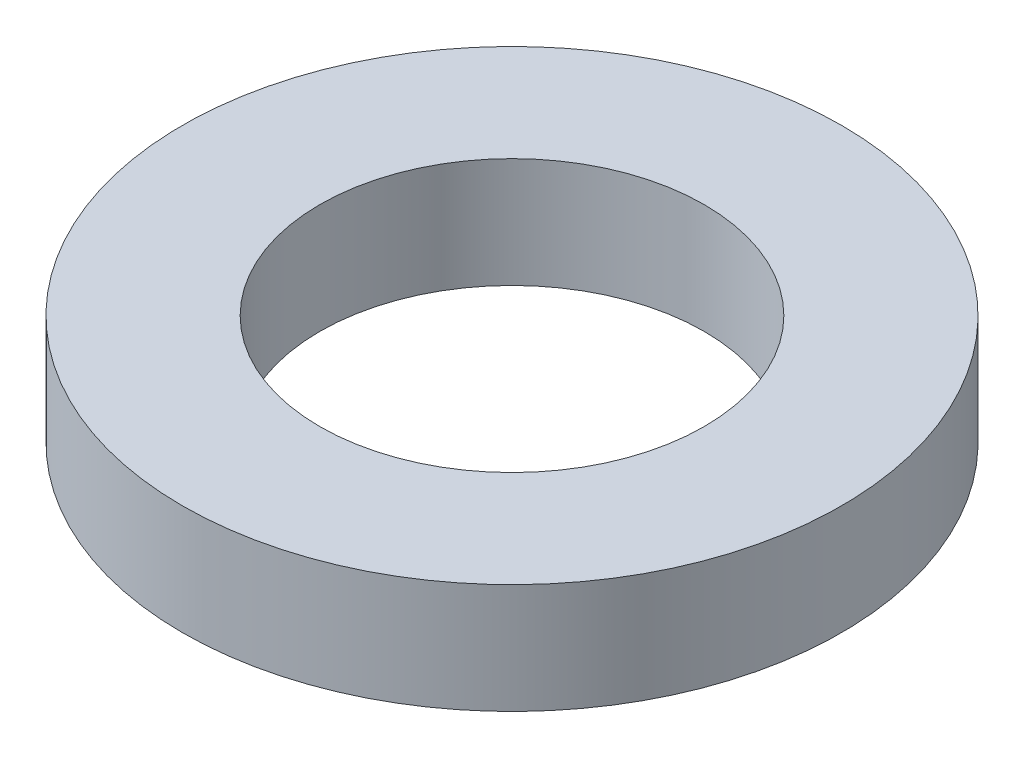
SolidWorks part; units mm, degrees
ref_plane "Front Plane" through (0, 0, 0) normal (0, 0, 1) x (1, 0, 0)
ref_plane "Top Plane" through (0, 0, 0) normal (0, 1, 0) x (1, 0, 0)
ref_plane "Right Plane" through (0, 0, 0) normal (1, 0, 0) x (0, 0, -1)
sketch "Sketch1" plane through (0, 0, 0) normal (0, 1, 0) x (1, 0, 0)
  circle A0 centre (0, 0) radius 19.05
  circle A1 centre (0, 0) radius 11.1125
  dimension "D1" = 38.1
  dimension "D2" = 22.225
extrude "Boss-Extrude1" add sketch "Sketch1" along normal blind 6.35
